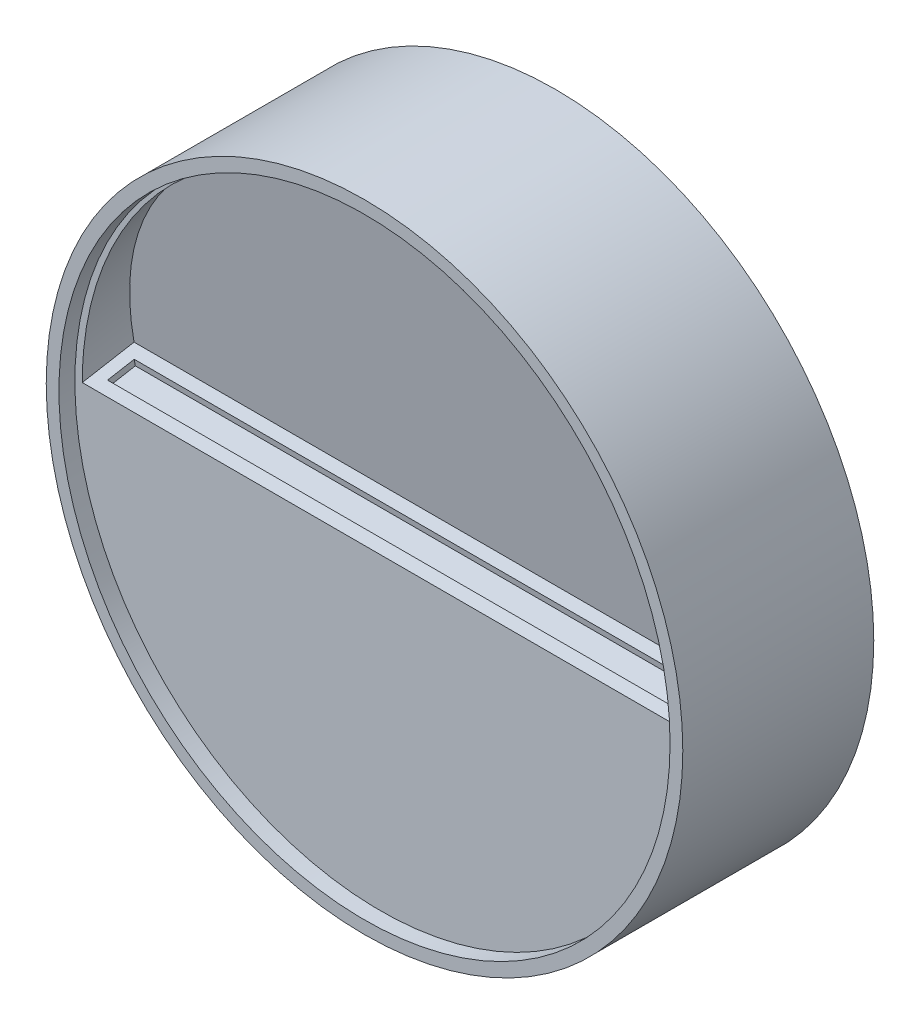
SolidWorks part; units mm, degrees
ref_plane "Alzado" through (0, 0, 0) normal (0, 0, 1) x (1, 0, 0)
ref_plane "Planta" through (0, 0, 0) normal (0, 1, 0) x (1, 0, 0)
ref_plane "Vista lateral" through (0, 0, 0) normal (1, 0, 0) x (0, 0, -1)
sketch "Croquis2" plane through (0, 0, 0) normal (0, 0, 1) x (1, 0, 0)
  circle A0 centre (0, 0) radius 50
  dimension "D1" = 100
extrude "Saliente-Extruir1" add sketch "Croquis2" along normal blind 30
sketch "Croquis3" plane through (0, 0, 30) normal (0, 0, 1) x (1, 0, 0)
  circle A2 centre (0, 0) radius 48
  circle A3 centre (0, 0) radius 48
  dimension "D1" = 2
extrude "Cortar-Extruir1" cut sketch "Croquis3" against normal blind 2.5
sketch "Croquis4" plane through (0, 0, 27.5) normal (0, 0, 1) x (1, 0, 0)
  point P8 (0, 8)
sketch "Croquis5" plane through (0, 0, 27.5) normal (0, 0, 1) x (1, 0, 0)
  line L1 (0, 48) -> (-42.2654, 48) construction
  circle A0 centre (0, 0) radius 48 construction
  circle A1 centre (0, 0) radius 48 construction
ref_plane "Plano2" through (0, -3.2554, 18.4623) normal (0, -0.1736, 0.9848) x (-1, 0, 0)
sketch "Croquis7" plane through (0, -3.2554, 18.4623) normal (0, -0.1736, 0.9848) x (-1, 0, 0)
  line L0 (46.8367, -5.2094) -> (-46.8367, -5.2094)
  arc A0 (-46.8367, -5.2094) -> (46.8367, -5.2094) centre (0, -5.2094) ccw
  point P6 (0, -5.2094)
  dimension "D1" = 93.6733
  dimension "D2" = 5.2094
extrude "Cortar-Extruir2" cut sketch "Croquis7" along normal through all
sketch "Croquis8" plane through (0, 5.1303, 0.9046) normal (0, 0.9848, 0.1736) x (1, 0, 0)
  line L12 (44.8367, -25.0057) -> (44.8367, -20.7471)
  line L13 (44.8367, -20.7471) -> (-44.8367, -20.7471)
  line L14 (-44.8367, -20.7471) -> (-44.8367, -25.0057)
  line L15 (-44.8367, -25.0057) -> (44.8367, -25.0057)
  line L16 (44.8367, -25.0057) -> (44.8367, -20.7471)
  line L17 (44.8367, -20.7471) -> (-44.8367, -20.7471)
  line L18 (-44.8367, -20.7471) -> (-44.8367, -25.0057)
  line L19 (-44.8367, -25.0057) -> (44.8367, -25.0057)
  dimension "D1" = 2
extrude "Cortar-Extruir3" cut sketch "Croquis8" against normal blind 1
